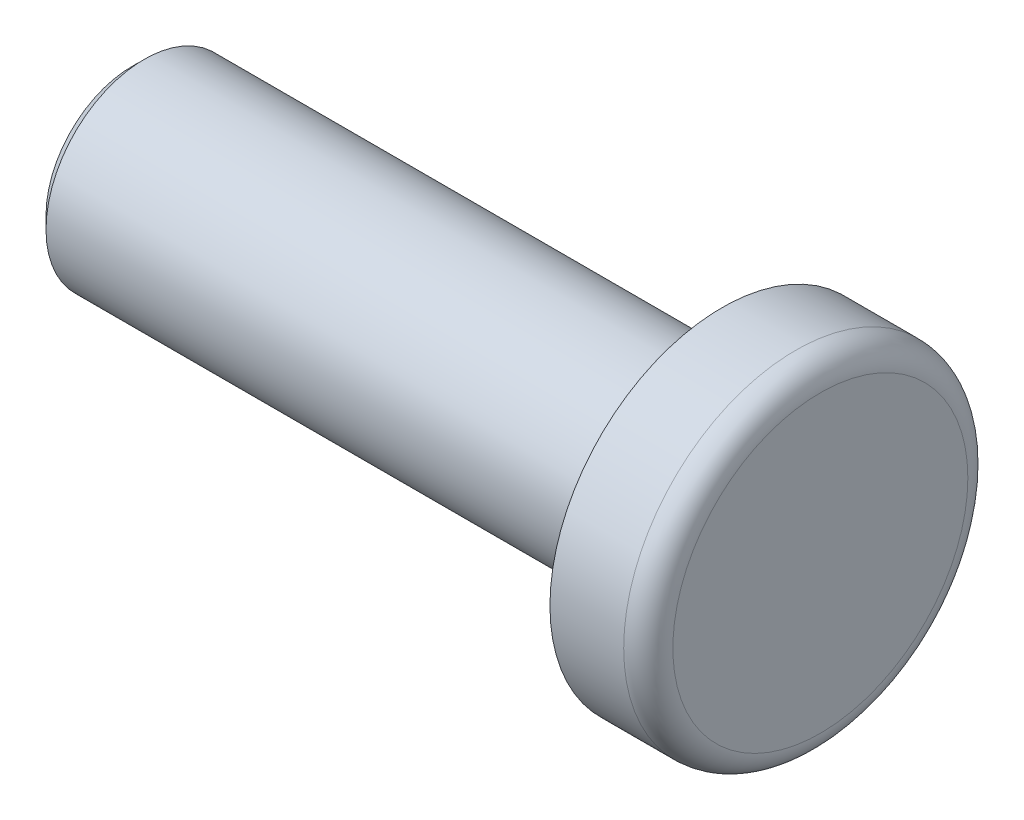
SolidWorks part; units mm, degrees
ref_plane "Спереди" through (0, 0, 0) normal (0, 0, 1) x (1, 0, 0)
ref_plane "Сверху" through (0, 0, 0) normal (0, 1, 0) x (1, 0, 0)
ref_plane "Справа" through (0, 0, 0) normal (1, 0, 0) x (0, 0, -1)
sketch "Эскиз1" plane through (0, 0, 0) normal (1, 0, 0) x (0, 0, -1)
  circle A0 centre (0, 0) radius 3.5
  dimension "D1" = 7
extrude "Бобышка-Вытянуть1" add sketch "Эскиз1" along normal blind 2
sketch "Эскиз2" plane through (0, 0, 0) normal (-1, 0, 0) x (0, 0, 1)
  circle A0 centre (0, 0) radius 2
  dimension "D1" = 4
extrude "Бобышка-Вытянуть2" add sketch "Эскиз2" along normal blind 12
chamfer "Фаска1" distance 0.25 angle 45 1 edges at (-12, 0, 2)
fillet "Скругление1" radius 0.5 1 edges at (2, 0, -3.5)
